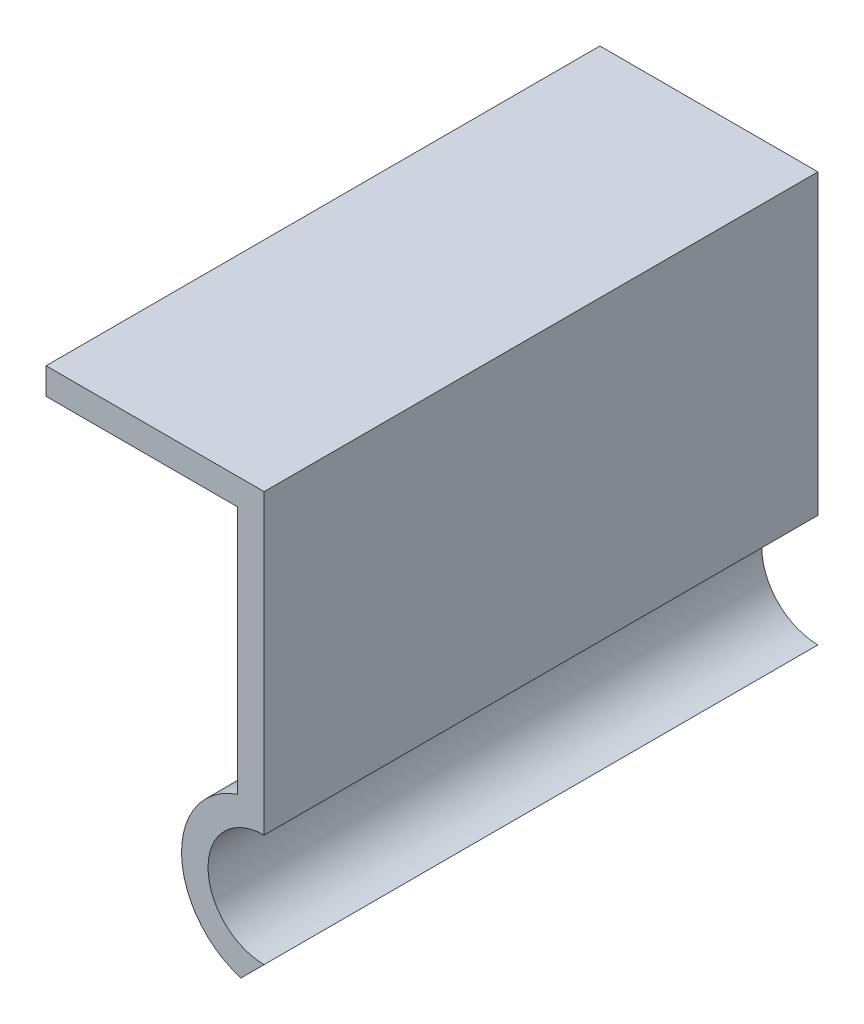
SolidWorks part; units mm, degrees
ref_plane "Front Plane" through (0, 0, 0) normal (0, 0, 1) x (1, 0, 0)
ref_plane "Top Plane" through (0, 0, 0) normal (0, 1, 0) x (1, 0, 0)
ref_plane "Right Plane" through (0, 0, 0) normal (1, 0, 0) x (0, 0, -1)
sketch "Sketch1" plane through (0, 0, 0) normal (0, 0, 1) x (1, 0, 0)
  line L0 (0, 0) -> (0, -13.642)
  line L1 (0, 0) -> (-10, 0)
  line L2 (-1.214, -1.214) -> (-10, -1.214)
  line L3 (-1.214, -1.214) -> (-1.214, -12.6279)
  line L4 (0, -13.642) -> (0, -56.7508) construction
  line L5 (0, -18.786) -> (-1.062, -19.848)
  line L6 (-10, 0) -> (-10, -1.214)
  arc A0 (0, -13.642) -> (0, -18.786) centre (0, -16.214) ccw
  arc A1 (-1.214, -12.6279) -> (-1.062, -19.848) centre (0, -16.214) ccw
  arc A2 (-1.214, -12.6279) -> (0, -20) centre (0, -16.214) ccw construction
  dimension "D3" = 3.786
  dimension "D2" = 45
  dimension "D4" = 15
  dimension "D5" = 10
  dimension "D1" = 1.214
extrude "Extrude1" add sketch "Sketch1" along normal blind 25.4
